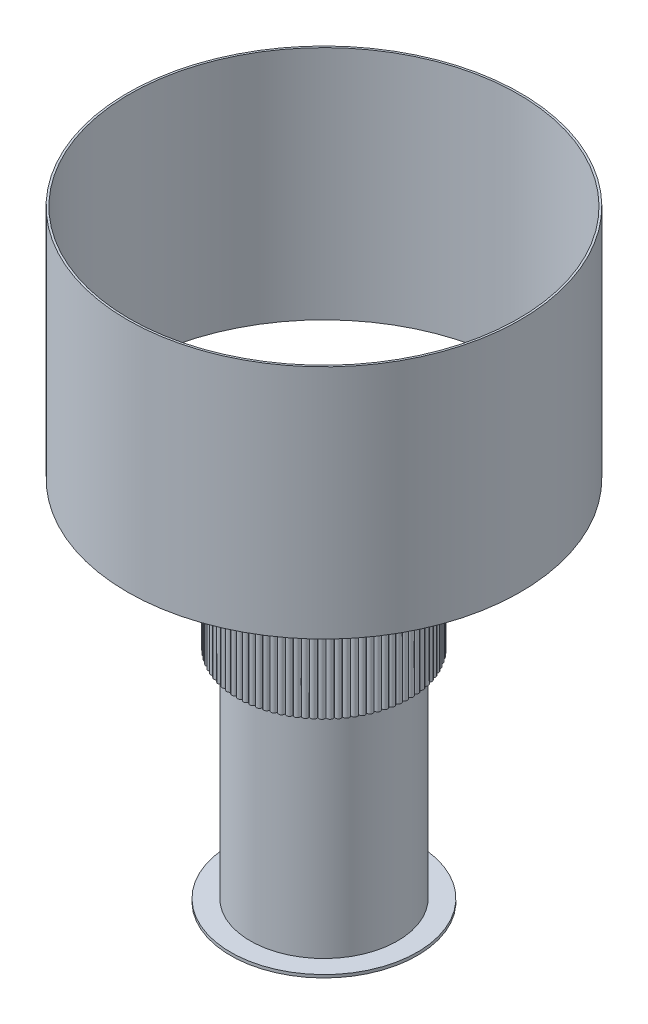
SolidWorks part; units mm, degrees
ref_plane "Alzado" through (0, 0, 0) normal (0, 0, 1) x (1, 0, 0)
ref_plane "Planta" through (0, 0, 0) normal (0, 1, 0) x (1, 0, 0)
ref_plane "Vista lateral" through (0, 0, 0) normal (1, 0, 0) x (0, 0, -1)
sketch "Croquis1" plane through (0, 0, 0) normal (0, 1, 0) x (1, 0, 0)
  arc A219 (2.9803, 85.3436) -> (-2.9803, 85.3436) centre (0, 85) ccw
  arc A221 (8.9263, 84.9278) -> (2.9803, 85.3436) centre (5.9293, 84.7929) ccw
  arc A223 (14.8288, 84.0982) -> (8.9263, 84.9278) centre (11.8297, 84.1728) ccw
  arc A308 (20.6591, 82.859) -> (14.8288, 84.0982) centre (17.6725, 83.1425) ccw
  arc A309 (26.3887, 81.216) -> (20.6591, 82.859) centre (23.4292, 81.7072) ccw
  arc A310 (31.9897, 79.1774) -> (26.3887, 81.216) centre (29.0717, 79.8739) ccw
  arc A311 (37.435, 76.753) -> (31.9897, 79.1774) centre (34.5726, 77.6514) ccw
  arc A312 (42.6978, 73.9547) -> (37.435, 76.753) centre (39.9051, 75.0505) ccw
  arc A313 (47.7526, 70.7961) -> (42.6978, 73.9547) centre (45.0431, 72.0841) ccw
  arc A314 (52.5748, 67.2926) -> (47.7526, 70.7961) centre (49.9617, 68.7664) ccw
  arc A315 (57.1408, 63.4613) -> (52.5748, 67.2926) centre (54.6369, 65.1138) ccw
  arc A316 (61.4284, 59.3208) -> (57.1408, 63.4613) centre (59.046, 61.1439) ccw
  arc A317 (65.4168, 54.8912) -> (61.4284, 59.3208) centre (63.1673, 56.8761) ccw
  arc A318 (69.0865, 50.1943) -> (65.4168, 54.8912) centre (66.9809, 52.3312) ccw
  arc A319 (72.4196, 45.2528) -> (69.0865, 50.1943) centre (70.4682, 47.5314) ccw
  arc A320 (75.3998, 40.0908) -> (72.4196, 45.2528) centre (73.6122, 42.5) ccw
  arc A321 (78.0127, 34.7335) -> (75.3998, 40.0908) centre (76.3975, 37.2615) ccw
  arc A322 (80.2456, 29.207) -> (78.0127, 34.7335) centre (78.8106, 31.8416) ccw
  arc A323 (82.0875, 23.5382) -> (80.2456, 29.207) centre (80.8398, 26.2664) ccw
  arc A324 (83.5295, 17.7547) -> (82.0875, 23.5382) centre (82.4751, 20.5634) ccw
  arc A325 (84.5645, 11.8848) -> (83.5295, 17.7547) centre (83.7087, 14.7601) ccw
  arc A326 (85.1876, 5.9569) -> (84.5645, 11.8848) centre (84.5344, 8.8849) ccw
  arc A327 (85.3956, 0) -> (85.1876, 5.9569) centre (84.9482, 2.9665) ccw
  arc A328 (85.1876, -5.9569) -> (85.3956, 0) centre (84.9482, -2.9665) ccw
  arc A329 (84.5645, -11.8848) -> (85.1876, -5.9569) centre (84.5344, -8.8849) ccw
  arc A330 (83.5295, -17.7547) -> (84.5645, -11.8848) centre (83.7087, -14.7601) ccw
  arc A331 (82.0875, -23.5382) -> (83.5295, -17.7547) centre (82.4751, -20.5634) ccw
  arc A332 (80.2456, -29.207) -> (82.0875, -23.5382) centre (80.8398, -26.2664) ccw
  arc A333 (78.0127, -34.7335) -> (80.2456, -29.207) centre (78.8106, -31.8416) ccw
  arc A334 (75.3998, -40.0908) -> (78.0127, -34.7335) centre (76.3975, -37.2615) ccw
  arc A335 (72.4196, -45.2528) -> (75.3998, -40.0908) centre (73.6122, -42.5) ccw
  arc A336 (69.0865, -50.1943) -> (72.4196, -45.2528) centre (70.4682, -47.5314) ccw
  arc A337 (65.4168, -54.8912) -> (69.0865, -50.1943) centre (66.9809, -52.3312) ccw
  arc A338 (61.4284, -59.3208) -> (65.4168, -54.8912) centre (63.1673, -56.8761) ccw
  arc A339 (57.1408, -63.4613) -> (61.4284, -59.3208) centre (59.046, -61.1439) ccw
  arc A340 (52.5748, -67.2926) -> (57.1408, -63.4613) centre (54.6369, -65.1138) ccw
  arc A341 (47.7526, -70.7961) -> (52.5748, -67.2926) centre (49.9617, -68.7664) ccw
  arc A342 (42.6978, -73.9547) -> (47.7526, -70.7961) centre (45.0431, -72.0841) ccw
  arc A343 (37.435, -76.753) -> (42.6978, -73.9547) centre (39.9051, -75.0505) ccw
  arc A344 (31.9897, -79.1774) -> (37.435, -76.753) centre (34.5726, -77.6514) ccw
  arc A345 (26.3887, -81.216) -> (31.9897, -79.1774) centre (29.0717, -79.8739) ccw
  arc A346 (20.6591, -82.859) -> (26.3887, -81.216) centre (23.4292, -81.7072) ccw
  arc A347 (14.8288, -84.0982) -> (20.6591, -82.859) centre (17.6725, -83.1425) ccw
  arc A348 (8.9263, -84.9278) -> (14.8288, -84.0982) centre (11.8297, -84.1728) ccw
  arc A349 (2.9803, -85.3436) -> (8.9263, -84.9278) centre (5.9293, -84.7929) ccw
  arc A350 (-2.9803, -85.3436) -> (2.9803, -85.3436) centre (0, -85) ccw
  arc A351 (-8.9263, -84.9278) -> (-2.9803, -85.3436) centre (-5.9293, -84.7929) ccw
  arc A352 (-14.8288, -84.0982) -> (-8.9263, -84.9278) centre (-11.8297, -84.1728) ccw
  arc A353 (-20.6591, -82.859) -> (-14.8288, -84.0982) centre (-17.6725, -83.1425) ccw
  arc A354 (-26.3887, -81.216) -> (-20.6591, -82.859) centre (-23.4292, -81.7072) ccw
  arc A355 (-31.9897, -79.1774) -> (-26.3887, -81.216) centre (-29.0717, -79.8739) ccw
  arc A356 (-37.435, -76.753) -> (-31.9897, -79.1774) centre (-34.5726, -77.6514) ccw
  arc A357 (-42.6978, -73.9547) -> (-37.435, -76.753) centre (-39.9051, -75.0505) ccw
  arc A358 (-47.7526, -70.7961) -> (-42.6978, -73.9547) centre (-45.0431, -72.0841) ccw
  arc A359 (-52.5748, -67.2926) -> (-47.7526, -70.7961) centre (-49.9617, -68.7664) ccw
  arc A360 (-57.1408, -63.4613) -> (-52.5748, -67.2926) centre (-54.6369, -65.1138) ccw
  arc A361 (-61.4284, -59.3208) -> (-57.1408, -63.4613) centre (-59.046, -61.1439) ccw
  arc A362 (-65.4168, -54.8912) -> (-61.4284, -59.3208) centre (-63.1673, -56.8761) ccw
  arc A363 (-69.0865, -50.1943) -> (-65.4168, -54.8912) centre (-66.9809, -52.3312) ccw
  arc A364 (-72.4196, -45.2528) -> (-69.0865, -50.1943) centre (-70.4682, -47.5314) ccw
  arc A365 (-75.3998, -40.0908) -> (-72.4196, -45.2528) centre (-73.6122, -42.5) ccw
  arc A366 (-78.0127, -34.7335) -> (-75.3998, -40.0908) centre (-76.3975, -37.2615) ccw
  arc A367 (-80.2456, -29.207) -> (-78.0127, -34.7335) centre (-78.8106, -31.8416) ccw
  arc A368 (-82.0875, -23.5382) -> (-80.2456, -29.207) centre (-80.8398, -26.2664) ccw
  arc A369 (-83.5295, -17.7547) -> (-82.0875, -23.5382) centre (-82.4751, -20.5634) ccw
  arc A370 (-84.5645, -11.8848) -> (-83.5295, -17.7547) centre (-83.7087, -14.7601) ccw
  arc A371 (-85.1876, -5.9569) -> (-84.5645, -11.8848) centre (-84.5344, -8.8849) ccw
  arc A372 (-85.3956, 0) -> (-85.1876, -5.9569) centre (-84.9482, -2.9665) ccw
  arc A373 (-85.1876, 5.9569) -> (-85.3956, 0) centre (-84.9482, 2.9665) ccw
  arc A374 (-84.5645, 11.8848) -> (-85.1876, 5.9569) centre (-84.5344, 8.8849) ccw
  arc A375 (-83.5295, 17.7547) -> (-84.5645, 11.8848) centre (-83.7087, 14.7601) ccw
  arc A376 (-82.0875, 23.5382) -> (-83.5295, 17.7547) centre (-82.4751, 20.5634) ccw
  arc A377 (-80.2456, 29.207) -> (-82.0875, 23.5382) centre (-80.8398, 26.2664) ccw
  arc A378 (-78.0127, 34.7335) -> (-80.2456, 29.207) centre (-78.8106, 31.8416) ccw
  arc A379 (-75.3998, 40.0908) -> (-78.0127, 34.7335) centre (-76.3975, 37.2615) ccw
  arc A380 (-72.4196, 45.2528) -> (-75.3998, 40.0908) centre (-73.6122, 42.5) ccw
  arc A381 (-69.0865, 50.1943) -> (-72.4196, 45.2528) centre (-70.4682, 47.5314) ccw
  arc A382 (-65.4168, 54.8912) -> (-69.0865, 50.1943) centre (-66.9809, 52.3312) ccw
  arc A383 (-61.4284, 59.3208) -> (-65.4168, 54.8912) centre (-63.1673, 56.8761) ccw
  arc A384 (-57.1408, 63.4613) -> (-61.4284, 59.3208) centre (-59.046, 61.1439) ccw
  arc A385 (-52.5748, 67.2926) -> (-57.1408, 63.4613) centre (-54.6369, 65.1138) ccw
  arc A386 (-47.7526, 70.7961) -> (-52.5748, 67.2926) centre (-49.9617, 68.7664) ccw
  arc A387 (-42.6978, 73.9547) -> (-47.7526, 70.7961) centre (-45.0431, 72.0841) ccw
  arc A388 (-37.435, 76.753) -> (-42.6978, 73.9547) centre (-39.9051, 75.0505) ccw
  arc A389 (-31.9897, 79.1774) -> (-37.435, 76.753) centre (-34.5726, 77.6514) ccw
  arc A390 (-26.3887, 81.216) -> (-31.9897, 79.1774) centre (-29.0717, 79.8739) ccw
  arc A391 (-20.6591, 82.859) -> (-26.3887, 81.216) centre (-23.4292, 81.7072) ccw
  arc A392 (-14.8288, 84.0982) -> (-20.6591, 82.859) centre (-17.6725, 83.1425) ccw
  arc A394 (-2.9803, 85.3436) -> (-8.9263, 84.9278) centre (-5.9293, 84.7929) ccw
  arc A395 (-8.9263, 84.9278) -> (-14.8288, 84.0982) centre (-11.8297, 84.1728) ccw
  arc A396 (-14.6734, 83.2171) -> (-8.8327, 84.038) centre (-11.8297, 84.1728) ccw
  point P185 (0, 0)
  dimension "D2" = 6
extrude "Saliente-Extruir1" add sketch "Croquis1" along normal blind 100
sketch "Croquis2" plane through (0, 0, 0) normal (0, -1, 0) x (1, 0, 0)
  circle A0 centre (0, 0) radius 77.5
  dimension "D1" = 155
extrude "Cortar-Extruir1" cut sketch "Croquis2" against normal blind 90
sketch "Croquis3" plane through (0, 100, 0) normal (0, 1, 0) x (1, 0, 0)
  circle A0 centre (0, 0) radius 5
  dimension "D1" = 10
extrude "Cortar-Extruir2" cut sketch "Croquis3" against normal blind 75
sketch "Croquis4" plane through (0, 90, 0) normal (0, -1, 0) x (1, 0, 0)
  circle A0 centre (0, 0) radius 75
  circle A1 centre (0, 0) radius 71
  dimension "D1" = 150
  dimension "D2" = 4
extrude "Saliente-Extruir2" add sketch "Croquis4" along normal blind 310 separate body
sketch "Croquis5" plane through (0, 100, 0) normal (0, 1, 0) x (1, 0, 0)
  circle A0 centre (0, 0) radius 6
  dimension "D1" = 12
extrude "Saliente-Extruir3" add sketch "Croquis5" along normal blind 50 separate body
sketch "Croquis6" plane through (0, 150, 0) normal (0, 1, 0) x (1, 0, 0)
  circle A0 centre (0, 0) radius 200
  circle A1 centre (0, 0) radius 198
  dimension "D1" = 400
  dimension "D2" = 396
extrude "Saliente-Extruir4" add sketch "Croquis6" along normal blind 240 separate body
sketch "Croquis7" plane through (0, -220, 0) normal (0, -1, 0) x (1, 0, 0)
  circle A0 centre (0, 0) radius 95
  dimension "D1" = 190
extrude "Saliente-Extruir5" add sketch "Croquis7" along normal blind 3 separate body
sketch "Croquis8" plane through (0, -223, 0) normal (0, -1, 0) x (1, 0, 0)
  line L0 (0, 0) -> (0, 70) construction
  line L1 (0, 0) -> (-60.6218, -35) construction
  line L2 (0, 0) -> (60.6218, -35) construction
  circle A0 centre (0, 70) radius 5
  circle A1 centre (-60.6218, -35) radius 5
  circle A2 centre (60.6218, -35) radius 5
  dimension "D3" = 10
  dimension "D4" = 10
  dimension "D5" = 10
  dimension "D1" = 120
  dimension "D2" = 120
  dimension "D6" = 70
  dimension "D7" = 70
  dimension "D8" = 70
extrude "Saliente-Extruir6" add sketch "Croquis8" along normal blind 5 separate body
fillet "Redondeo1" radius 1 1 edges at (0, -228, 65)
fillet "Redondeo2" radius 1 1 edges at (-60.6218, -228, -40)
fillet "Redondeo3" radius 1 1 edges at (60.6218, -228, -40)
sketch "Croquis9" plane through (0, 100, 0) normal (0, 1, 0) x (1, 0, 0)
  circle A0 centre (0, 0) radius 15
  dimension "D1" = 30
extrude "Saliente-Extruir7" add sketch "Croquis9" along normal blind 2 separate body
